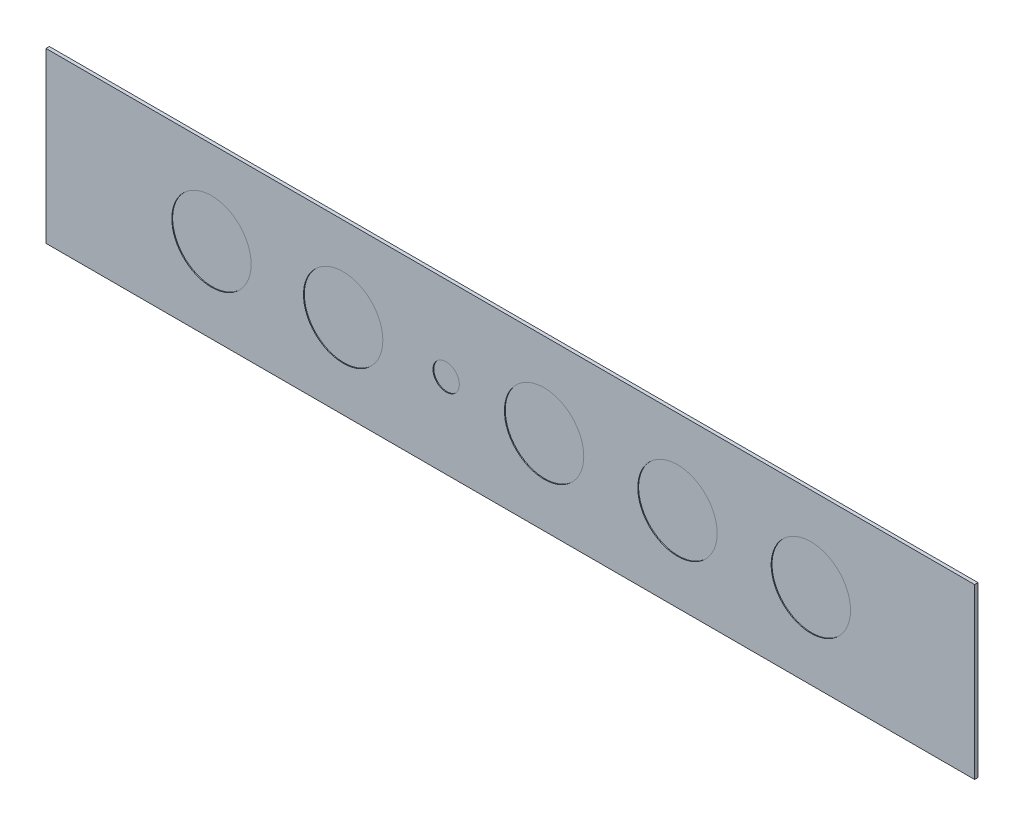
SolidWorks part; units mm, degrees
ref_plane "Front Plane" through (0, 0, 0) normal (0, 0, 1) x (1, 0, 0)
ref_plane "Top Plane" through (0, 0, 0) normal (0, 1, 0) x (1, 0, 0)
ref_plane "Right Plane" through (0, 0, 0) normal (1, 0, 0) x (0, 0, -1)
sketch "Sketch1" plane through (0, 0, 0) normal (0, 0, 1) x (1, 0, 0)
  line L1 (-69.85, 12.7) -> (69.85, 12.7)
  line L2 (-69.85, 12.7) -> (-69.85, -12.7)
  line L3 (-69.85, -12.7) -> (69.85, -12.7)
  line L4 (69.85, 12.7) -> (69.85, -12.7)
  point P4 (-69.85, 0)
  point P6 (0, 12.7)
  dimension "D1" = 25.4
  dimension "D2" = 139.7
extrude "Boss-Extrude1" add sketch "Sketch1" along normal blind 0.508
sketch "Sketch2" plane through (0, 0, 0.508) normal (0, 0, 1) x (1, 0, 0)
  line L1 (-69.85, 12.7) -> (-69.85, -12.7) construction
  circle A3 centre (-44.958, 0) radius 5.969
  circle A4 centre (-25.146, 0) radius 5.969
  circle A5 centre (-9.652, 0) radius 1.9812
  circle A6 centre (5.08, 0) radius 5.969
  circle A7 centre (25.146, 0) radius 5.969
  circle A8 centre (45.212, 0) radius 5.969
  point P14 (-69.85, 0)
  dimension "D1" = 11.938
  dimension "D2" = 3.9624
  dimension "D3" = 24.892
  dimension "D4" = 44.704
  dimension "D5" = 60.198
  dimension "D6" = 74.93
  dimension "D7" = 94.996
  dimension "D8" = 115.062
extrude "Cut-Extrude1" cut sketch "Sketch2" against normal blind 0.127
ref_plane "Plane1" through (0, 0, 0) normal (-1, 0, 0) x (0, 0, 1)
